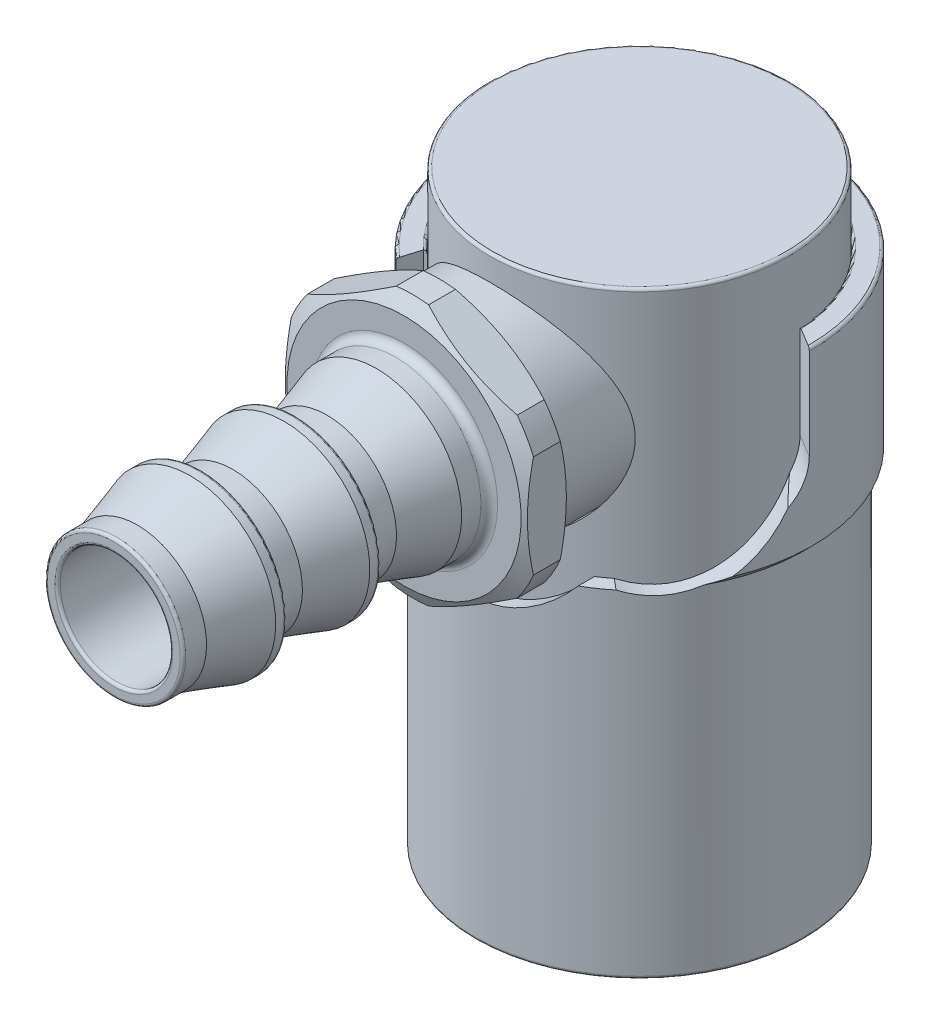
SolidWorks part; units mm, degrees
ref_plane "Front Plane" through (0, 0, 0) normal (0, 0, 1) x (1, 0, 0)
ref_plane "Top Plane" through (0, 0, 0) normal (0, 1, 0) x (1, 0, 0)
ref_plane "Right Plane" through (0, 0, 0) normal (1, 0, 0) x (0, 0, -1)
imported_body "BODY"
imported_body "SLEEVE"
imported_body "BARB"
sketch "Sketch1" plane through (0, 0, 0) normal (1, 0, 0) x (0, 0, -1)
  line L0 (-10.668, 23.9776) -> (10.668, 23.9776) construction
  line L1 (-10.668, 23.9776) -> (-7.9248, 23.9776)
  line L2 (-10.668, 23.9776) -> (-10.668, 17.6276)
  line L3 (-10.668, 17.6276) -> (-7.9248, 17.6276)
  line L4 (-7.9248, 23.9776) -> (-7.9248, 17.6276)
  line L5 (-7.9248, 23.9776) -> (7.9248, 23.9776) construction
  line L6 (0, 27.6882) -> (0, 18.6367) construction
  dimension "D1" = 6.35
revolve "SC500S-V" add sketch "Sketch1" angle 360 about L6
